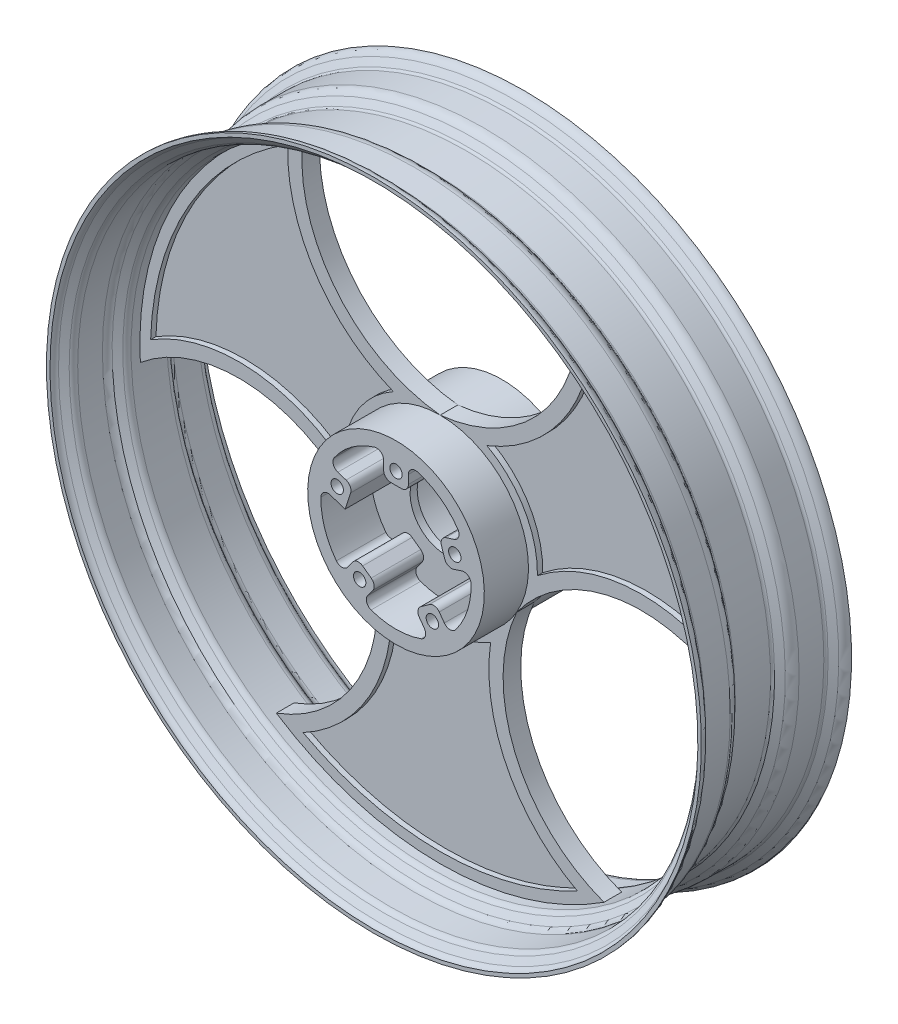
SolidWorks part; units mm, degrees
ref_plane "Front Plane" through (0, 0, 0) normal (0, 0, 1) x (1, 0, 0)
ref_plane "Top Plane" through (0, 0, 0) normal (0, 1, 0) x (1, 0, 0)
ref_plane "Right Plane" through (0, 0, 0) normal (1, 0, 0) x (0, 0, -1)
sketch "Sketch1" plane through (0, 0, 0) normal (1, 0, 0) x (0, 0, -1)
  line L0 (0, 50.9127) -> (0, -50.9127) construction
  line L1 (-50.9127, 0) -> (50.9127, 0) construction
  line L2 (-38.1, 0) -> (38.1, 0)
  line L3 (38.1, 0) -> (38.1, 63.5)
  line L4 (-38.1, 0) -> (-38.1, 63.5)
  line L5 (38.1, 63.5) -> (6.35, 63.5)
  line L6 (-38.1, 63.5) -> (-6.35, 63.5)
  line L7 (6.35, 63.5) -> (6.35, 215.9)
  line L8 (-6.35, 63.5) -> (-6.35, 215.9)
  line L9 (6.35, 215.9) -> (12.7, 215.9)
  line L10 (-6.35, 215.9) -> (-12.7, 215.9)
  line L11 (16.6883, 217.8337) -> (20.0832, 222.137)
  line L12 (-16.6883, 217.8337) -> (-20.0832, 222.137)
  line L13 (24.7695, 224.409) -> (42.5495, 224.409)
  line L14 (-24.7695, 224.409) -> (-42.5495, 224.409)
  line L15 (46.6294, 226.4624) -> (49.895, 230.8646)
  line L16 (-46.6294, 226.4624) -> (-49.895, 230.8646)
  line L17 (53.975, 232.918) -> (53.975, 235.458)
  line L18 (-53.975, 232.918) -> (-53.975, 235.458)
  line L19 (47.855, 232.3779) -> (44.5894, 227.9757)
  line L20 (-47.855, 232.3779) -> (-44.5894, 227.9757)
  line L21 (42.5495, 226.949) -> (24.7695, 226.949)
  line L22 (-42.5495, 226.949) -> (-24.7695, 226.949)
  line L23 (18.089, 223.7101) -> (14.6942, 219.4068)
  line L24 (-18.089, 223.7101) -> (-14.6942, 219.4068)
  line L25 (12.7, 218.44) -> (-12.7, 218.44)
  arc A0 (12.7, 215.9) -> (16.6883, 217.8337) centre (12.7, 220.98) ccw
  arc A1 (-12.7, 215.9) -> (-16.6883, 217.8337) centre (-12.7, 220.98) cw
  arc A2 (20.0832, 222.137) -> (24.7695, 224.409) centre (24.7695, 218.44) cw
  arc A3 (-20.0832, 222.137) -> (-24.7695, 224.409) centre (-24.7695, 218.44) ccw
  arc A4 (42.5495, 224.409) -> (46.6294, 226.4624) centre (42.5495, 229.489) ccw
  arc A5 (-42.5495, 224.409) -> (-46.6294, 226.4624) centre (-42.5495, 229.489) cw
  arc A6 (49.895, 230.8646) -> (53.975, 232.918) centre (53.975, 227.838) cw
  arc A7 (-49.895, 230.8646) -> (-53.975, 232.918) centre (-53.975, 227.838) ccw
  arc A8 (53.975, 235.458) -> (47.855, 232.3779) centre (53.975, 227.838) ccw
  arc A9 (-53.975, 235.458) -> (-47.855, 232.3779) centre (-53.975, 227.838) cw
  arc A10 (44.5894, 227.9757) -> (42.5495, 226.949) centre (42.5495, 229.489) cw
  arc A11 (-44.5894, 227.9757) -> (-42.5495, 226.949) centre (-42.5495, 229.489) ccw
  arc A12 (24.7695, 226.949) -> (18.089, 223.7101) centre (24.7695, 218.44) ccw
  arc A13 (-24.7695, 226.949) -> (-18.089, 223.7101) centre (-24.7695, 218.44) cw
  arc A14 (14.6942, 219.4068) -> (12.7, 218.44) centre (12.7, 220.98) cw
  arc A15 (-14.6942, 219.4068) -> (-12.7, 218.44) centre (-12.7, 220.98) ccw
  point P9 (0, 0)
  point P61 (0, 218.44)
  dimension "D3" = 5.08
  dimension "D1" = 2.54
  dimension "D2" = 12.7
  dimension "D4" = 53.975
  dimension "D5" = 17.78
  dimension "D6" = 8.509
  dimension "D7" = 8.509
  dimension "D8" = 31.75
  dimension "D9" = 63.5
  dimension "D10" = 76.2
  dimension "D11" = 431.8
revolve "Revolve1" add sketch "Sketch1" angle 360 about L1
sketch "Sketch2" plane through (0, 0, 6.35) normal (0, 0, 1) x (1, 0, 0)
  line L0 (0, 0) -> (0, 254.0596) construction
  arc A0 (0, 63.5) -> (97.7983, 192.4794) centre (-11.0385, 173.4372) ccw
  arc A1 (0, 63.5) -> (-97.7983, 192.4794) centre (11.0385, 173.4372) cw
  circle A7 centre (0, 0) radius 63.5 construction
  circle A8 centre (0, 0) radius 215.9 construction
  circle A10 centre (0, 0) radius 215.9 construction
  arc A11 (-97.7983, 192.4794) -> (97.7983, 192.4794) centre (0, 0) cw
  dimension "D1" = 110.49
  dimension "D2" = 53.87
extrude "Cut-Extrude1" cut sketch "Sketch2" against normal up to next
pattern_circular "CirPattern1" count 3 over 360 about axis through (0, 0, 0) along (0, 0, 1) of "Cut-Extrude1"
sketch "Sketch4" plane through (0, 0, 6.35) normal (0, 0, 1) x (1, 0, 0)
  line L0 (0, 0) -> (-235.5281, 135.9822) construction
  line L1 (0, 0) -> (0, 259.2316) construction
  arc A0 (-208.1829, 6.3606) -> (-69.9217, -1.5257) centre (-144.6818, -96.2782) cw
  arc A1 (-33.6396, 61.3169) -> (-109.5998, 177.1114) centre (11.0385, 173.4372) cw
  arc A2 (-33.6396, 61.3169) -> (-69.9217, -1.5257) centre (0, 0) ccw
  arc A3 (-109.5998, 177.1114) -> (-208.1829, 6.3606) centre (0, 0) ccw
  circle A16 centre (0, 0) radius 63.5 construction
  arc A17 (-54.9926, -31.75) -> (-215.5912, -11.5439) centre (-144.6818, -96.2782) ccw construction
  arc A19 (-97.7983, 192.4794) -> (0, 63.5) centre (11.0385, 173.4372) ccw construction
  dimension "D3" = 56.5
  dimension "D4" = 208.28
  dimension "D1" = 60
  dimension "D2" = 62.5
extrude "Cut-Extrude2" cut sketch "Sketch4" against normal blind 3.81
pattern_circular "CirPattern2" count 3 over 360 about axis through (0, 0, 0) along (0, 0, 1) of "Cut-Extrude2"
mirror "Mirror1" about plane through (0, 0, 0) normal (0, 0, 1) of "CirPattern2", "Cut-Extrude2"
sketch "Sketch5" plane through (0, 0, 38.1) normal (0, 0, 1) x (1, 0, 0)
  circle A0 centre (0, 0) radius 53.975
  dimension "D1" = 107.95
extrude "Cut-Extrude3" cut sketch "Sketch5" against normal up to surface (35.56 mm away)
mirror "Mirror4" about plane through (0, 0, 0) normal (0, 0, 1) of "Cut-Extrude3"
sketch "Sketch7" plane through (0, 0, 2.54) normal (0, 0, 1) x (1, 0, 0)
  circle A0 centre (0, 0) radius 25.4
  dimension "D1" = 50.8
extrude "Cut-Extrude4" cut sketch "Sketch7" against normal up to next
sketch "Sketch8" plane through (0, 0, 38.1) normal (0, 0, 1) x (1, 0, 0)
  line L0 (0, 0) -> (0, 76.2199) construction
  line L3 (-8.89, 53.2378) -> (-8.89, 35.56)
  line L4 (-8.89, 35.56) -> (8.89, 35.56)
  line L5 (8.89, 53.2378) -> (8.89, 35.56)
  circle A0 centre (0, 0) radius 53.975 construction
  arc A1 (8.89, 53.2378) -> (-8.89, 53.2378) centre (0, 0) ccw
  dimension "D1" = 17.78
  dimension "D2" = 35.56
extrude "Boss-Extrude2" add sketch "Sketch8" against normal up to next
sketch "Sketch9" plane through (0, 0, 38.1) normal (0, 0, 1) x (1, 0, 0)
  circle A0 centre (0, 44.45) radius 4.445
  dimension "D1" = 8.89
  dimension "D2" = 44.45
extrude "Cut-Extrude5" cut sketch "Sketch9" against normal blind 25.4
pattern_circular "CirPattern3" count 5 over 360 about axis through (0, 0, 0) along (0, 0, 1) of "Boss-Extrude2", "Cut-Extrude5"
fillet "Fillet1" radius 5.08 19 edges at (-38.4846, -37.8449, 20.32) (-28.0938, -23.5432, 20.32) (-24.1003, -48.2957, 20.32) (-13.7095, -33.9941, 20.32) (24.1003, -48.2957, 20.32) (13.7095, -33.9941, 20.32) (38.4846, -37.8449, 20.32) (28.0938, -23.5432, 20.32) (47.885, 24.9063, 20.32) (53.3794, 7.9965, 20.32) (31.0724, 19.4435, 20.32) (36.5667, 2.5338, 20.32) (-8.89, 53.2378, 20.32) (8.89, 53.2378, 20.32) (8.89, 35.56, 20.32) (-8.89, 35.56, 20.32) (-53.3794, 7.9965, 20.32) (-47.885, 24.9063, 20.32) (-31.0724, 19.4435, 20.32)
